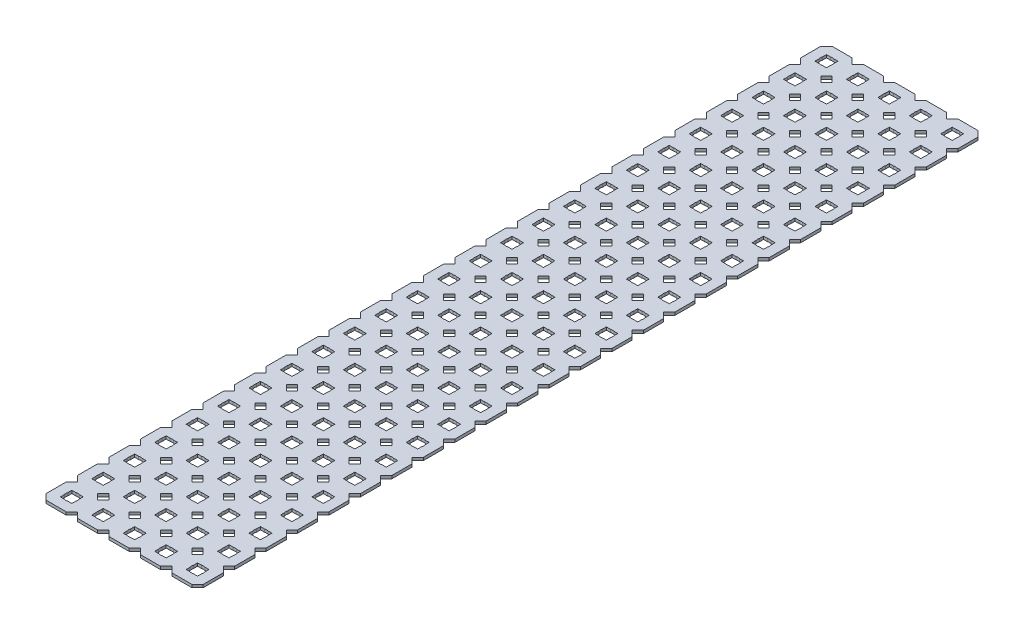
SolidWorks part; units mm, degrees
ref_plane "Front Plane" through (0, 0, 0) normal (0, 0, 1) x (1, 0, 0)
ref_plane "Top Plane" through (0, 0, 0) normal (0, 1, 0) x (1, 0, 0)
ref_plane "Right Plane" through (0, 0, 0) normal (1, 0, 0) x (0, 0, -1)
ref_plane "Plane1" through (0, 0, 0) normal (0, -1, 0) x (1, 0, 0)
sketch "Sketch1" plane through (0, 0, 0) normal (0, -1, 0) x (1, 0, 0)
  line L0 (2.281, -317.5) -> (10.419, -317.5)
  line L1 (10.419, -317.5) -> (12.7, -315.219)
  line L2 (12.7, -315.219) -> (14.981, -317.5)
  line L3 (14.981, -317.5) -> (23.119, -317.5)
  line L4 (23.119, -317.5) -> (25.4, -315.219)
  line L5 (25.4, -315.219) -> (27.681, -317.5)
  line L6 (27.681, -317.5) -> (35.819, -317.5)
  line L7 (35.819, -317.5) -> (38.1, -315.219)
  line L8 (38.1, -315.219) -> (40.381, -317.5)
  line L9 (40.381, -317.5) -> (48.519, -317.5)
  line L10 (48.519, -317.5) -> (50.8, -315.219)
  line L11 (50.8, -315.219) -> (53.081, -317.5)
  line L12 (53.081, -317.5) -> (61.219, -317.5)
  line L13 (61.219, -317.5) -> (63.5, -315.219)
  line L14 (63.5, -315.219) -> (63.5, -307.081)
  line L15 (63.5, -307.081) -> (61.219, -304.8)
  line L16 (61.219, -304.8) -> (63.5, -302.519)
  line L17 (63.5, -302.519) -> (63.5, -294.381)
  line L18 (63.5, -294.381) -> (61.219, -292.1)
  line L19 (61.219, -292.1) -> (63.5, -289.819)
  line L20 (63.5, -289.819) -> (63.5, -281.681)
  line L21 (63.5, -281.681) -> (61.219, -279.4)
  line L22 (61.219, -279.4) -> (63.5, -277.119)
  line L23 (63.5, -277.119) -> (63.5, -268.981)
  line L24 (63.5, -268.981) -> (61.219, -266.7)
  line L25 (61.219, -266.7) -> (63.5, -264.419)
  line L26 (63.5, -264.419) -> (63.5, -256.281)
  line L27 (63.5, -256.281) -> (61.219, -254)
  line L28 (61.219, -254) -> (63.5, -251.719)
  line L29 (63.5, -251.719) -> (63.5, -243.581)
  line L30 (63.5, -243.581) -> (61.219, -241.3)
  line L31 (61.219, -241.3) -> (63.5, -239.019)
  line L32 (63.5, -239.019) -> (63.5, -230.881)
  line L33 (63.5, -230.881) -> (61.219, -228.6)
  line L34 (61.219, -228.6) -> (63.5, -226.319)
  line L35 (63.5, -226.319) -> (63.5, -218.181)
  line L36 (63.5, -218.181) -> (61.219, -215.9)
  line L37 (61.219, -215.9) -> (63.5, -213.619)
  line L38 (63.5, -213.619) -> (63.5, -205.481)
  line L39 (63.5, -205.481) -> (61.219, -203.2)
  line L40 (61.219, -203.2) -> (63.5, -200.919)
  line L41 (63.5, -200.919) -> (63.5, -192.781)
  line L42 (63.5, -192.781) -> (61.219, -190.5)
  line L43 (61.219, -190.5) -> (63.5, -188.219)
  line L44 (63.5, -188.219) -> (63.5, -180.081)
  line L45 (63.5, -180.081) -> (61.219, -177.8)
  line L46 (61.219, -177.8) -> (63.5, -175.519)
  line L47 (63.5, -175.519) -> (63.5, -167.381)
  line L48 (63.5, -167.381) -> (61.219, -165.1)
  line L49 (61.219, -165.1) -> (63.5, -162.819)
  line L50 (63.5, -162.819) -> (63.5, -154.681)
  line L51 (63.5, -154.681) -> (61.219, -152.4)
  line L52 (61.219, -152.4) -> (63.5, -150.119)
  line L53 (63.5, -150.119) -> (63.5, -141.981)
  line L54 (63.5, -141.981) -> (61.219, -139.7)
  line L55 (61.219, -139.7) -> (63.5, -137.419)
  line L56 (63.5, -137.419) -> (63.5, -129.281)
  line L57 (63.5, -129.281) -> (61.219, -127)
  line L58 (61.219, -127) -> (63.5, -124.719)
  line L59 (63.5, -124.719) -> (63.5, -116.581)
  line L60 (63.5, -116.581) -> (61.219, -114.3)
  line L61 (61.219, -114.3) -> (63.5, -112.019)
  line L62 (63.5, -112.019) -> (63.5, -103.881)
  line L63 (63.5, -103.881) -> (61.219, -101.6)
  line L64 (61.219, -101.6) -> (63.5, -99.319)
  line L65 (63.5, -99.319) -> (63.5, -91.181)
  line L66 (63.5, -91.181) -> (61.219, -88.9)
  line L67 (61.219, -88.9) -> (63.5, -86.619)
  line L68 (63.5, -86.619) -> (63.5, -78.481)
  line L69 (63.5, -78.481) -> (61.219, -76.2)
  line L70 (61.219, -76.2) -> (63.5, -73.919)
  line L71 (63.5, -73.919) -> (63.5, -65.781)
  line L72 (63.5, -65.781) -> (61.219, -63.5)
  line L73 (61.219, -63.5) -> (63.5, -61.219)
  line L74 (63.5, -61.219) -> (63.5, -53.081)
  line L75 (63.5, -53.081) -> (61.219, -50.8)
  line L76 (61.219, -50.8) -> (63.5, -48.519)
  line L77 (63.5, -48.519) -> (63.5, -40.381)
  line L78 (63.5, -40.381) -> (61.219, -38.1)
  line L79 (61.219, -38.1) -> (63.5, -35.819)
  line L80 (63.5, -35.819) -> (63.5, -27.681)
  line L81 (63.5, -27.681) -> (61.219, -25.4)
  line L82 (61.219, -25.4) -> (63.5, -23.119)
  line L83 (63.5, -23.119) -> (63.5, -14.981)
  line L84 (63.5, -14.981) -> (61.219, -12.7)
  line L85 (61.219, -12.7) -> (63.5, -10.419)
  line L86 (63.5, -10.419) -> (63.5, -2.281)
  line L87 (63.5, -2.281) -> (61.219, 0)
  line L88 (61.219, 0) -> (53.081, 0)
  line L89 (53.081, 0) -> (50.8, -2.281)
  line L90 (50.8, -2.281) -> (48.519, 0)
  line L91 (48.519, 0) -> (40.381, 0)
  line L92 (40.381, 0) -> (38.1, -2.281)
  line L93 (38.1, -2.281) -> (35.819, 0)
  line L94 (35.819, 0) -> (27.681, 0)
  line L95 (27.681, 0) -> (25.4, -2.281)
  line L96 (25.4, -2.281) -> (23.119, 0)
  line L97 (23.119, 0) -> (14.981, 0)
  line L98 (14.981, 0) -> (12.7, -2.281)
  line L99 (12.7, -2.281) -> (10.419, 0)
  line L100 (10.419, 0) -> (2.281, 0)
  line L101 (2.281, 0) -> (0, -2.281)
  line L102 (0, -2.281) -> (0, -10.419)
  line L103 (0, -10.419) -> (2.281, -12.7)
  line L104 (2.281, -12.7) -> (0, -14.981)
  line L105 (0, -14.981) -> (0, -23.119)
  line L106 (0, -23.119) -> (2.281, -25.4)
  line L107 (2.281, -25.4) -> (0, -27.681)
  line L108 (0, -27.681) -> (0, -35.819)
  line L109 (0, -35.819) -> (2.281, -38.1)
  line L110 (2.281, -38.1) -> (0, -40.381)
  line L111 (0, -40.381) -> (0, -48.519)
  line L112 (0, -48.519) -> (2.281, -50.8)
  line L113 (2.281, -50.8) -> (0, -53.081)
  line L114 (0, -53.081) -> (0, -61.219)
  line L115 (0, -61.219) -> (2.281, -63.5)
  line L116 (2.281, -63.5) -> (0, -65.781)
  line L117 (0, -65.781) -> (0, -73.919)
  line L118 (0, -73.919) -> (2.281, -76.2)
  line L119 (2.281, -76.2) -> (0, -78.481)
  line L120 (0, -78.481) -> (0, -86.619)
  line L121 (0, -86.619) -> (2.281, -88.9)
  line L122 (2.281, -88.9) -> (0, -91.181)
  line L123 (0, -91.181) -> (0, -99.319)
  line L124 (0, -99.319) -> (2.281, -101.6)
  line L125 (2.281, -101.6) -> (0, -103.881)
  line L126 (0, -103.881) -> (0, -112.019)
  line L127 (0, -112.019) -> (2.281, -114.3)
  line L128 (2.281, -114.3) -> (0, -116.581)
  line L129 (0, -116.581) -> (0, -124.719)
  line L130 (0, -124.719) -> (2.281, -127)
  line L131 (2.281, -127) -> (0, -129.281)
  line L132 (0, -129.281) -> (0, -137.419)
  line L133 (0, -137.419) -> (2.281, -139.7)
  line L134 (2.281, -139.7) -> (0, -141.981)
  line L135 (0, -141.981) -> (0, -150.119)
  line L136 (0, -150.119) -> (2.281, -152.4)
  line L137 (2.281, -152.4) -> (0, -154.681)
  line L138 (0, -154.681) -> (0, -162.819)
  line L139 (0, -162.819) -> (2.281, -165.1)
  line L140 (2.281, -165.1) -> (0, -167.381)
  line L141 (0, -167.381) -> (0, -175.519)
  line L142 (0, -175.519) -> (2.281, -177.8)
  line L143 (2.281, -177.8) -> (0, -180.081)
  line L144 (0, -180.081) -> (0, -188.219)
  line L145 (0, -188.219) -> (2.281, -190.5)
  line L146 (2.281, -190.5) -> (0, -192.781)
  line L147 (0, -192.781) -> (0, -200.919)
  line L148 (0, -200.919) -> (2.281, -203.2)
  line L149 (2.281, -203.2) -> (0, -205.481)
  line L150 (0, -205.481) -> (0, -213.619)
  line L151 (0, -213.619) -> (2.281, -215.9)
  line L152 (2.281, -215.9) -> (0, -218.181)
  line L153 (0, -218.181) -> (0, -226.319)
  line L154 (0, -226.319) -> (2.281, -228.6)
  line L155 (2.281, -228.6) -> (0, -230.881)
  line L156 (0, -230.881) -> (0, -239.019)
  line L157 (0, -239.019) -> (2.281, -241.3)
  line L158 (2.281, -241.3) -> (0, -243.581)
  line L159 (0, -243.581) -> (0, -251.719)
  line L160 (0, -251.719) -> (2.281, -254)
  line L161 (2.281, -254) -> (0, -256.281)
  line L162 (0, -256.281) -> (0, -264.419)
  line L163 (0, -264.419) -> (2.281, -266.7)
  line L164 (2.281, -266.7) -> (0, -268.981)
  line L165 (0, -268.981) -> (0, -277.119)
  line L166 (0, -277.119) -> (2.281, -279.4)
  line L167 (2.281, -279.4) -> (0, -281.681)
  line L168 (0, -281.681) -> (0, -289.819)
  line L169 (0, -289.819) -> (2.281, -292.1)
  line L170 (2.281, -292.1) -> (0, -294.381)
  line L171 (0, -294.381) -> (0, -302.519)
  line L172 (0, -302.519) -> (2.281, -304.8)
  line L173 (2.281, -304.8) -> (0, -307.081)
  line L174 (0, -307.081) -> (0, -315.219)
  line L175 (0, -315.219) -> (2.281, -317.5)
  line L176 (14.981, -292.1) -> (12.7, -294.381)
  line L177 (12.7, -294.381) -> (10.419, -292.1)
  line L178 (10.419, -292.1) -> (12.7, -289.819)
  line L179 (12.7, -289.819) -> (14.981, -292.1)
  line L180 (14.981, -266.7) -> (12.7, -268.981)
  line L181 (12.7, -268.981) -> (10.419, -266.7)
  line L182 (10.419, -266.7) -> (12.7, -264.419)
  line L183 (12.7, -264.419) -> (14.981, -266.7)
  line L184 (14.981, -241.3) -> (12.7, -243.581)
  line L185 (12.7, -243.581) -> (10.419, -241.3)
  line L186 (10.419, -241.3) -> (12.7, -239.019)
  line L187 (12.7, -239.019) -> (14.981, -241.3)
  line L188 (14.981, -215.9) -> (12.7, -218.181)
  line L189 (12.7, -218.181) -> (10.419, -215.9)
  line L190 (10.419, -215.9) -> (12.7, -213.619)
  line L191 (12.7, -213.619) -> (14.981, -215.9)
  line L192 (14.981, -190.5) -> (12.7, -192.781)
  line L193 (12.7, -192.781) -> (10.419, -190.5)
  line L194 (10.419, -190.5) -> (12.7, -188.219)
  line L195 (12.7, -188.219) -> (14.981, -190.5)
  line L196 (14.981, -165.1) -> (12.7, -167.381)
  line L197 (12.7, -167.381) -> (10.419, -165.1)
  line L198 (10.419, -165.1) -> (12.7, -162.819)
  line L199 (12.7, -162.819) -> (14.981, -165.1)
  line L200 (14.981, -139.7) -> (12.7, -141.981)
  line L201 (12.7, -141.981) -> (10.419, -139.7)
  line L202 (10.419, -139.7) -> (12.7, -137.419)
  line L203 (12.7, -137.419) -> (14.981, -139.7)
  line L204 (14.981, -114.3) -> (12.7, -116.581)
  line L205 (12.7, -116.581) -> (10.419, -114.3)
  line L206 (10.419, -114.3) -> (12.7, -112.019)
  line L207 (12.7, -112.019) -> (14.981, -114.3)
  line L208 (14.981, -88.9) -> (12.7, -91.181)
  line L209 (12.7, -91.181) -> (10.419, -88.9)
  line L210 (10.419, -88.9) -> (12.7, -86.619)
  line L211 (12.7, -86.619) -> (14.981, -88.9)
  line L212 (14.981, -63.5) -> (12.7, -65.781)
  line L213 (12.7, -65.781) -> (10.419, -63.5)
  line L214 (10.419, -63.5) -> (12.7, -61.219)
  line L215 (12.7, -61.219) -> (14.981, -63.5)
  line L216 (14.981, -38.1) -> (12.7, -40.381)
  line L217 (12.7, -40.381) -> (10.419, -38.1)
  line L218 (10.419, -38.1) -> (12.7, -35.819)
  line L219 (12.7, -35.819) -> (14.981, -38.1)
  line L220 (14.981, -12.7) -> (12.7, -14.981)
  line L221 (12.7, -14.981) -> (10.419, -12.7)
  line L222 (10.419, -12.7) -> (12.7, -10.419)
  line L223 (12.7, -10.419) -> (14.981, -12.7)
  line L224 (27.681, -304.8) -> (25.4, -307.081)
  line L225 (25.4, -307.081) -> (23.119, -304.8)
  line L226 (23.119, -304.8) -> (25.4, -302.519)
  line L227 (25.4, -302.519) -> (27.681, -304.8)
  line L228 (27.681, -279.4) -> (25.4, -281.681)
  line L229 (25.4, -281.681) -> (23.119, -279.4)
  line L230 (23.119, -279.4) -> (25.4, -277.119)
  line L231 (25.4, -277.119) -> (27.681, -279.4)
  line L232 (27.681, -254) -> (25.4, -256.281)
  line L233 (25.4, -256.281) -> (23.119, -254)
  line L234 (23.119, -254) -> (25.4, -251.719)
  line L235 (25.4, -251.719) -> (27.681, -254)
  line L236 (27.681, -228.6) -> (25.4, -230.881)
  line L237 (25.4, -230.881) -> (23.119, -228.6)
  line L238 (23.119, -228.6) -> (25.4, -226.319)
  line L239 (25.4, -226.319) -> (27.681, -228.6)
  line L240 (27.681, -203.2) -> (25.4, -205.481)
  line L241 (25.4, -205.481) -> (23.119, -203.2)
  line L242 (23.119, -203.2) -> (25.4, -200.919)
  line L243 (25.4, -200.919) -> (27.681, -203.2)
  line L244 (27.681, -177.8) -> (25.4, -180.081)
  line L245 (25.4, -180.081) -> (23.119, -177.8)
  line L246 (23.119, -177.8) -> (25.4, -175.519)
  line L247 (25.4, -175.519) -> (27.681, -177.8)
  line L248 (27.681, -152.4) -> (25.4, -154.681)
  line L249 (25.4, -154.681) -> (23.119, -152.4)
  line L250 (23.119, -152.4) -> (25.4, -150.119)
  line L251 (25.4, -150.119) -> (27.681, -152.4)
  line L252 (27.681, -127) -> (25.4, -129.281)
  line L253 (25.4, -129.281) -> (23.119, -127)
  line L254 (23.119, -127) -> (25.4, -124.719)
  line L255 (25.4, -124.719) -> (27.681, -127)
  line L256 (27.681, -101.6) -> (25.4, -103.881)
  line L257 (25.4, -103.881) -> (23.119, -101.6)
  line L258 (23.119, -101.6) -> (25.4, -99.319)
  line L259 (25.4, -99.319) -> (27.681, -101.6)
  line L260 (27.681, -76.2) -> (25.4, -78.481)
  line L261 (25.4, -78.481) -> (23.119, -76.2)
  line L262 (23.119, -76.2) -> (25.4, -73.919)
  line L263 (25.4, -73.919) -> (27.681, -76.2)
  line L264 (27.681, -50.8) -> (25.4, -53.081)
  line L265 (25.4, -53.081) -> (23.119, -50.8)
  line L266 (23.119, -50.8) -> (25.4, -48.519)
  line L267 (25.4, -48.519) -> (27.681, -50.8)
  line L268 (27.681, -25.4) -> (25.4, -27.681)
  line L269 (25.4, -27.681) -> (23.119, -25.4)
  line L270 (23.119, -25.4) -> (25.4, -23.119)
  line L271 (25.4, -23.119) -> (27.681, -25.4)
  line L272 (40.381, -292.1) -> (38.1, -294.381)
  line L273 (38.1, -294.381) -> (35.819, -292.1)
  line L274 (35.819, -292.1) -> (38.1, -289.819)
  line L275 (38.1, -289.819) -> (40.381, -292.1)
  line L276 (40.381, -266.7) -> (38.1, -268.981)
  line L277 (38.1, -268.981) -> (35.819, -266.7)
  line L278 (35.819, -266.7) -> (38.1, -264.419)
  line L279 (38.1, -264.419) -> (40.381, -266.7)
  line L280 (40.381, -241.3) -> (38.1, -243.581)
  line L281 (38.1, -243.581) -> (35.819, -241.3)
  line L282 (35.819, -241.3) -> (38.1, -239.019)
  line L283 (38.1, -239.019) -> (40.381, -241.3)
  line L284 (40.381, -215.9) -> (38.1, -218.181)
  line L285 (38.1, -218.181) -> (35.819, -215.9)
  line L286 (35.819, -215.9) -> (38.1, -213.619)
  line L287 (38.1, -213.619) -> (40.381, -215.9)
  line L288 (40.381, -190.5) -> (38.1, -192.781)
  line L289 (38.1, -192.781) -> (35.819, -190.5)
  line L290 (35.819, -190.5) -> (38.1, -188.219)
  line L291 (38.1, -188.219) -> (40.381, -190.5)
  line L292 (40.381, -165.1) -> (38.1, -167.381)
  line L293 (38.1, -167.381) -> (35.819, -165.1)
  line L294 (35.819, -165.1) -> (38.1, -162.819)
  line L295 (38.1, -162.819) -> (40.381, -165.1)
  line L296 (40.381, -139.7) -> (38.1, -141.981)
  line L297 (38.1, -141.981) -> (35.819, -139.7)
  line L298 (35.819, -139.7) -> (38.1, -137.419)
  line L299 (38.1, -137.419) -> (40.381, -139.7)
  line L300 (40.381, -114.3) -> (38.1, -116.581)
  line L301 (38.1, -116.581) -> (35.819, -114.3)
  line L302 (35.819, -114.3) -> (38.1, -112.019)
  line L303 (38.1, -112.019) -> (40.381, -114.3)
  line L304 (40.381, -88.9) -> (38.1, -91.181)
  line L305 (38.1, -91.181) -> (35.819, -88.9)
  line L306 (35.819, -88.9) -> (38.1, -86.619)
  line L307 (38.1, -86.619) -> (40.381, -88.9)
  line L308 (40.381, -63.5) -> (38.1, -65.781)
  line L309 (38.1, -65.781) -> (35.819, -63.5)
  line L310 (35.819, -63.5) -> (38.1, -61.219)
  line L311 (38.1, -61.219) -> (40.381, -63.5)
  line L312 (40.381, -38.1) -> (38.1, -40.381)
  line L313 (38.1, -40.381) -> (35.819, -38.1)
  line L314 (35.819, -38.1) -> (38.1, -35.819)
  line L315 (38.1, -35.819) -> (40.381, -38.1)
  line L316 (40.381, -12.7) -> (38.1, -14.981)
  line L317 (38.1, -14.981) -> (35.819, -12.7)
  line L318 (35.819, -12.7) -> (38.1, -10.419)
  line L319 (38.1, -10.419) -> (40.381, -12.7)
  line L320 (53.081, -304.8) -> (50.8, -307.081)
  line L321 (50.8, -307.081) -> (48.519, -304.8)
  line L322 (48.519, -304.8) -> (50.8, -302.519)
  line L323 (50.8, -302.519) -> (53.081, -304.8)
  line L324 (53.081, -279.4) -> (50.8, -281.681)
  line L325 (50.8, -281.681) -> (48.519, -279.4)
  line L326 (48.519, -279.4) -> (50.8, -277.119)
  line L327 (50.8, -277.119) -> (53.081, -279.4)
  line L328 (53.081, -254) -> (50.8, -256.281)
  line L329 (50.8, -256.281) -> (48.519, -254)
  line L330 (48.519, -254) -> (50.8, -251.719)
  line L331 (50.8, -251.719) -> (53.081, -254)
  line L332 (53.081, -228.6) -> (50.8, -230.881)
  line L333 (50.8, -230.881) -> (48.519, -228.6)
  line L334 (48.519, -228.6) -> (50.8, -226.319)
  line L335 (50.8, -226.319) -> (53.081, -228.6)
  line L336 (53.081, -203.2) -> (50.8, -205.481)
  line L337 (50.8, -205.481) -> (48.519, -203.2)
  line L338 (48.519, -203.2) -> (50.8, -200.919)
  line L339 (50.8, -200.919) -> (53.081, -203.2)
  line L340 (53.081, -177.8) -> (50.8, -180.081)
  line L341 (50.8, -180.081) -> (48.519, -177.8)
  line L342 (48.519, -177.8) -> (50.8, -175.519)
  line L343 (50.8, -175.519) -> (53.081, -177.8)
  line L344 (53.081, -152.4) -> (50.8, -154.681)
  line L345 (50.8, -154.681) -> (48.519, -152.4)
  line L346 (48.519, -152.4) -> (50.8, -150.119)
  line L347 (50.8, -150.119) -> (53.081, -152.4)
  line L348 (53.081, -127) -> (50.8, -129.281)
  line L349 (50.8, -129.281) -> (48.519, -127)
  line L350 (48.519, -127) -> (50.8, -124.719)
  line L351 (50.8, -124.719) -> (53.081, -127)
  line L352 (53.081, -101.6) -> (50.8, -103.881)
  line L353 (50.8, -103.881) -> (48.519, -101.6)
  line L354 (48.519, -101.6) -> (50.8, -99.319)
  line L355 (50.8, -99.319) -> (53.081, -101.6)
  line L356 (53.081, -76.2) -> (50.8, -78.481)
  line L357 (50.8, -78.481) -> (48.519, -76.2)
  line L358 (48.519, -76.2) -> (50.8, -73.919)
  line L359 (50.8, -73.919) -> (53.081, -76.2)
  line L360 (53.081, -50.8) -> (50.8, -53.081)
  line L361 (50.8, -53.081) -> (48.519, -50.8)
  line L362 (48.519, -50.8) -> (50.8, -48.519)
  line L363 (50.8, -48.519) -> (53.081, -50.8)
  line L364 (53.081, -25.4) -> (50.8, -27.681)
  line L365 (50.8, -27.681) -> (48.519, -25.4)
  line L366 (48.519, -25.4) -> (50.8, -23.119)
  line L367 (50.8, -23.119) -> (53.081, -25.4)
  line L368 (4.0386, -308.8386) -> (8.6614, -308.8386)
  line L369 (8.6614, -308.8386) -> (8.6614, -313.4614)
  line L370 (8.6614, -313.4614) -> (4.0386, -313.4614)
  line L371 (4.0386, -313.4614) -> (4.0386, -308.8386)
  line L372 (16.7386, -308.8386) -> (21.3614, -308.8386)
  line L373 (21.3614, -308.8386) -> (21.3614, -313.4614)
  line L374 (21.3614, -313.4614) -> (16.7386, -313.4614)
  line L375 (16.7386, -313.4614) -> (16.7386, -308.8386)
  line L376 (29.4386, -308.8386) -> (34.0614, -308.8386)
  line L377 (34.0614, -308.8386) -> (34.0614, -313.4614)
  line L378 (34.0614, -313.4614) -> (29.4386, -313.4614)
  line L379 (29.4386, -313.4614) -> (29.4386, -308.8386)
  line L380 (42.1386, -308.8386) -> (46.7614, -308.8386)
  line L381 (46.7614, -308.8386) -> (46.7614, -313.4614)
  line L382 (46.7614, -313.4614) -> (42.1386, -313.4614)
  line L383 (42.1386, -313.4614) -> (42.1386, -308.8386)
  line L384 (54.8386, -308.8386) -> (59.4614, -308.8386)
  line L385 (59.4614, -308.8386) -> (59.4614, -313.4614)
  line L386 (59.4614, -313.4614) -> (54.8386, -313.4614)
  line L387 (54.8386, -313.4614) -> (54.8386, -308.8386)
  line L388 (4.0386, -296.1386) -> (8.6614, -296.1386)
  line L389 (8.6614, -296.1386) -> (8.6614, -300.7614)
  line L390 (8.6614, -300.7614) -> (4.0386, -300.7614)
  line L391 (4.0386, -300.7614) -> (4.0386, -296.1386)
  line L392 (54.8386, -296.1386) -> (59.4614, -296.1386)
  line L393 (59.4614, -296.1386) -> (59.4614, -300.7614)
  line L394 (59.4614, -300.7614) -> (54.8386, -300.7614)
  line L395 (54.8386, -300.7614) -> (54.8386, -296.1386)
  line L396 (4.0386, -283.4386) -> (8.6614, -283.4386)
  line L397 (8.6614, -283.4386) -> (8.6614, -288.0614)
  line L398 (8.6614, -288.0614) -> (4.0386, -288.0614)
  line L399 (4.0386, -288.0614) -> (4.0386, -283.4386)
  line L400 (54.8386, -283.4386) -> (59.4614, -283.4386)
  line L401 (59.4614, -283.4386) -> (59.4614, -288.0614)
  line L402 (59.4614, -288.0614) -> (54.8386, -288.0614)
  line L403 (54.8386, -288.0614) -> (54.8386, -283.4386)
  line L404 (4.0386, -270.7386) -> (8.6614, -270.7386)
  line L405 (8.6614, -270.7386) -> (8.6614, -275.3614)
  line L406 (8.6614, -275.3614) -> (4.0386, -275.3614)
  line L407 (4.0386, -275.3614) -> (4.0386, -270.7386)
  line L408 (54.8386, -270.7386) -> (59.4614, -270.7386)
  line L409 (59.4614, -270.7386) -> (59.4614, -275.3614)
  line L410 (59.4614, -275.3614) -> (54.8386, -275.3614)
  line L411 (54.8386, -275.3614) -> (54.8386, -270.7386)
  line L412 (4.0386, -258.0386) -> (8.6614, -258.0386)
  line L413 (8.6614, -258.0386) -> (8.6614, -262.6614)
  line L414 (8.6614, -262.6614) -> (4.0386, -262.6614)
  line L415 (4.0386, -262.6614) -> (4.0386, -258.0386)
  line L416 (54.8386, -258.0386) -> (59.4614, -258.0386)
  line L417 (59.4614, -258.0386) -> (59.4614, -262.6614)
  line L418 (59.4614, -262.6614) -> (54.8386, -262.6614)
  line L419 (54.8386, -262.6614) -> (54.8386, -258.0386)
  line L420 (4.0386, -245.3386) -> (8.6614, -245.3386)
  line L421 (8.6614, -245.3386) -> (8.6614, -249.9614)
  line L422 (8.6614, -249.9614) -> (4.0386, -249.9614)
  line L423 (4.0386, -249.9614) -> (4.0386, -245.3386)
  line L424 (54.8386, -245.3386) -> (59.4614, -245.3386)
  line L425 (59.4614, -245.3386) -> (59.4614, -249.9614)
  line L426 (59.4614, -249.9614) -> (54.8386, -249.9614)
  line L427 (54.8386, -249.9614) -> (54.8386, -245.3386)
  line L428 (4.0386, -232.6386) -> (8.6614, -232.6386)
  line L429 (8.6614, -232.6386) -> (8.6614, -237.2614)
  line L430 (8.6614, -237.2614) -> (4.0386, -237.2614)
  line L431 (4.0386, -237.2614) -> (4.0386, -232.6386)
  line L432 (54.8386, -232.6386) -> (59.4614, -232.6386)
  line L433 (59.4614, -232.6386) -> (59.4614, -237.2614)
  line L434 (59.4614, -237.2614) -> (54.8386, -237.2614)
  line L435 (54.8386, -237.2614) -> (54.8386, -232.6386)
  line L436 (4.0386, -219.9386) -> (8.6614, -219.9386)
  line L437 (8.6614, -219.9386) -> (8.6614, -224.5614)
  line L438 (8.6614, -224.5614) -> (4.0386, -224.5614)
  line L439 (4.0386, -224.5614) -> (4.0386, -219.9386)
  line L440 (54.8386, -219.9386) -> (59.4614, -219.9386)
  line L441 (59.4614, -219.9386) -> (59.4614, -224.5614)
  line L442 (59.4614, -224.5614) -> (54.8386, -224.5614)
  line L443 (54.8386, -224.5614) -> (54.8386, -219.9386)
  line L444 (4.0386, -207.2386) -> (8.6614, -207.2386)
  line L445 (8.6614, -207.2386) -> (8.6614, -211.8614)
  line L446 (8.6614, -211.8614) -> (4.0386, -211.8614)
  line L447 (4.0386, -211.8614) -> (4.0386, -207.2386)
  line L448 (54.8386, -207.2386) -> (59.4614, -207.2386)
  line L449 (59.4614, -207.2386) -> (59.4614, -211.8614)
  line L450 (59.4614, -211.8614) -> (54.8386, -211.8614)
  line L451 (54.8386, -211.8614) -> (54.8386, -207.2386)
  line L452 (4.0386, -194.5386) -> (8.6614, -194.5386)
  line L453 (8.6614, -194.5386) -> (8.6614, -199.1614)
  line L454 (8.6614, -199.1614) -> (4.0386, -199.1614)
  line L455 (4.0386, -199.1614) -> (4.0386, -194.5386)
  line L456 (54.8386, -194.5386) -> (59.4614, -194.5386)
  line L457 (59.4614, -194.5386) -> (59.4614, -199.1614)
  line L458 (59.4614, -199.1614) -> (54.8386, -199.1614)
  line L459 (54.8386, -199.1614) -> (54.8386, -194.5386)
  line L460 (4.0386, -181.8386) -> (8.6614, -181.8386)
  line L461 (8.6614, -181.8386) -> (8.6614, -186.4614)
  line L462 (8.6614, -186.4614) -> (4.0386, -186.4614)
  line L463 (4.0386, -186.4614) -> (4.0386, -181.8386)
  line L464 (54.8386, -181.8386) -> (59.4614, -181.8386)
  line L465 (59.4614, -181.8386) -> (59.4614, -186.4614)
  line L466 (59.4614, -186.4614) -> (54.8386, -186.4614)
  line L467 (54.8386, -186.4614) -> (54.8386, -181.8386)
  line L468 (4.0386, -169.1386) -> (8.6614, -169.1386)
  line L469 (8.6614, -169.1386) -> (8.6614, -173.7614)
  line L470 (8.6614, -173.7614) -> (4.0386, -173.7614)
  line L471 (4.0386, -173.7614) -> (4.0386, -169.1386)
  line L472 (54.8386, -169.1386) -> (59.4614, -169.1386)
  line L473 (59.4614, -169.1386) -> (59.4614, -173.7614)
  line L474 (59.4614, -173.7614) -> (54.8386, -173.7614)
  line L475 (54.8386, -173.7614) -> (54.8386, -169.1386)
  line L476 (4.0386, -156.4386) -> (8.6614, -156.4386)
  line L477 (8.6614, -156.4386) -> (8.6614, -161.0614)
  line L478 (8.6614, -161.0614) -> (4.0386, -161.0614)
  line L479 (4.0386, -161.0614) -> (4.0386, -156.4386)
  line L480 (54.8386, -156.4386) -> (59.4614, -156.4386)
  line L481 (59.4614, -156.4386) -> (59.4614, -161.0614)
  line L482 (59.4614, -161.0614) -> (54.8386, -161.0614)
  line L483 (54.8386, -161.0614) -> (54.8386, -156.4386)
  line L484 (4.0386, -143.7386) -> (8.6614, -143.7386)
  line L485 (8.6614, -143.7386) -> (8.6614, -148.3614)
  line L486 (8.6614, -148.3614) -> (4.0386, -148.3614)
  line L487 (4.0386, -148.3614) -> (4.0386, -143.7386)
  line L488 (54.8386, -143.7386) -> (59.4614, -143.7386)
  line L489 (59.4614, -143.7386) -> (59.4614, -148.3614)
  line L490 (59.4614, -148.3614) -> (54.8386, -148.3614)
  line L491 (54.8386, -148.3614) -> (54.8386, -143.7386)
  line L492 (4.0386, -131.0386) -> (8.6614, -131.0386)
  line L493 (8.6614, -131.0386) -> (8.6614, -135.6614)
  line L494 (8.6614, -135.6614) -> (4.0386, -135.6614)
  line L495 (4.0386, -135.6614) -> (4.0386, -131.0386)
  line L496 (54.8386, -131.0386) -> (59.4614, -131.0386)
  line L497 (59.4614, -131.0386) -> (59.4614, -135.6614)
  line L498 (59.4614, -135.6614) -> (54.8386, -135.6614)
  line L499 (54.8386, -135.6614) -> (54.8386, -131.0386)
  line L500 (4.0386, -118.3386) -> (8.6614, -118.3386)
  line L501 (8.6614, -118.3386) -> (8.6614, -122.9614)
  line L502 (8.6614, -122.9614) -> (4.0386, -122.9614)
  line L503 (4.0386, -122.9614) -> (4.0386, -118.3386)
  line L504 (54.8386, -118.3386) -> (59.4614, -118.3386)
  line L505 (59.4614, -118.3386) -> (59.4614, -122.9614)
  line L506 (59.4614, -122.9614) -> (54.8386, -122.9614)
  line L507 (54.8386, -122.9614) -> (54.8386, -118.3386)
  line L508 (4.0386, -105.6386) -> (8.6614, -105.6386)
  line L509 (8.6614, -105.6386) -> (8.6614, -110.2614)
  line L510 (8.6614, -110.2614) -> (4.0386, -110.2614)
  line L511 (4.0386, -110.2614) -> (4.0386, -105.6386)
  line L512 (54.8386, -105.6386) -> (59.4614, -105.6386)
  line L513 (59.4614, -105.6386) -> (59.4614, -110.2614)
  line L514 (59.4614, -110.2614) -> (54.8386, -110.2614)
  line L515 (54.8386, -110.2614) -> (54.8386, -105.6386)
  line L516 (4.0386, -92.9386) -> (8.6614, -92.9386)
  line L517 (8.6614, -92.9386) -> (8.6614, -97.5614)
  line L518 (8.6614, -97.5614) -> (4.0386, -97.5614)
  line L519 (4.0386, -97.5614) -> (4.0386, -92.9386)
  line L520 (54.8386, -92.9386) -> (59.4614, -92.9386)
  line L521 (59.4614, -92.9386) -> (59.4614, -97.5614)
  line L522 (59.4614, -97.5614) -> (54.8386, -97.5614)
  line L523 (54.8386, -97.5614) -> (54.8386, -92.9386)
  line L524 (4.0386, -80.2386) -> (8.6614, -80.2386)
  line L525 (8.6614, -80.2386) -> (8.6614, -84.8614)
  line L526 (8.6614, -84.8614) -> (4.0386, -84.8614)
  line L527 (4.0386, -84.8614) -> (4.0386, -80.2386)
  line L528 (54.8386, -80.2386) -> (59.4614, -80.2386)
  line L529 (59.4614, -80.2386) -> (59.4614, -84.8614)
  line L530 (59.4614, -84.8614) -> (54.8386, -84.8614)
  line L531 (54.8386, -84.8614) -> (54.8386, -80.2386)
  line L532 (4.0386, -67.5386) -> (8.6614, -67.5386)
  line L533 (8.6614, -67.5386) -> (8.6614, -72.1614)
  line L534 (8.6614, -72.1614) -> (4.0386, -72.1614)
  line L535 (4.0386, -72.1614) -> (4.0386, -67.5386)
  line L536 (54.8386, -67.5386) -> (59.4614, -67.5386)
  line L537 (59.4614, -67.5386) -> (59.4614, -72.1614)
  line L538 (59.4614, -72.1614) -> (54.8386, -72.1614)
  line L539 (54.8386, -72.1614) -> (54.8386, -67.5386)
  line L540 (4.0386, -54.8386) -> (8.6614, -54.8386)
  line L541 (8.6614, -54.8386) -> (8.6614, -59.4614)
  line L542 (8.6614, -59.4614) -> (4.0386, -59.4614)
  line L543 (4.0386, -59.4614) -> (4.0386, -54.8386)
  line L544 (54.8386, -54.8386) -> (59.4614, -54.8386)
  line L545 (59.4614, -54.8386) -> (59.4614, -59.4614)
  line L546 (59.4614, -59.4614) -> (54.8386, -59.4614)
  line L547 (54.8386, -59.4614) -> (54.8386, -54.8386)
  line L548 (4.0386, -42.1386) -> (8.6614, -42.1386)
  line L549 (8.6614, -42.1386) -> (8.6614, -46.7614)
  line L550 (8.6614, -46.7614) -> (4.0386, -46.7614)
  line L551 (4.0386, -46.7614) -> (4.0386, -42.1386)
  line L552 (54.8386, -42.1386) -> (59.4614, -42.1386)
  line L553 (59.4614, -42.1386) -> (59.4614, -46.7614)
  line L554 (59.4614, -46.7614) -> (54.8386, -46.7614)
  line L555 (54.8386, -46.7614) -> (54.8386, -42.1386)
  line L556 (4.0386, -29.4386) -> (8.6614, -29.4386)
  line L557 (8.6614, -29.4386) -> (8.6614, -34.0614)
  line L558 (8.6614, -34.0614) -> (4.0386, -34.0614)
  line L559 (4.0386, -34.0614) -> (4.0386, -29.4386)
  line L560 (54.8386, -29.4386) -> (59.4614, -29.4386)
  line L561 (59.4614, -29.4386) -> (59.4614, -34.0614)
  line L562 (59.4614, -34.0614) -> (54.8386, -34.0614)
  line L563 (54.8386, -34.0614) -> (54.8386, -29.4386)
  line L564 (4.0386, -16.7386) -> (8.6614, -16.7386)
  line L565 (8.6614, -16.7386) -> (8.6614, -21.3614)
  line L566 (8.6614, -21.3614) -> (4.0386, -21.3614)
  line L567 (4.0386, -21.3614) -> (4.0386, -16.7386)
  line L568 (54.8386, -16.7386) -> (59.4614, -16.7386)
  line L569 (59.4614, -16.7386) -> (59.4614, -21.3614)
  line L570 (59.4614, -21.3614) -> (54.8386, -21.3614)
  line L571 (54.8386, -21.3614) -> (54.8386, -16.7386)
  line L572 (4.0386, -4.0386) -> (8.6614, -4.0386)
  line L573 (8.6614, -4.0386) -> (8.6614, -8.6614)
  line L574 (8.6614, -8.6614) -> (4.0386, -8.6614)
  line L575 (4.0386, -8.6614) -> (4.0386, -4.0386)
  line L576 (16.7386, -4.0386) -> (21.3614, -4.0386)
  line L577 (21.3614, -4.0386) -> (21.3614, -8.6614)
  line L578 (21.3614, -8.6614) -> (16.7386, -8.6614)
  line L579 (16.7386, -8.6614) -> (16.7386, -4.0386)
  line L580 (29.4386, -4.0386) -> (34.0614, -4.0386)
  line L581 (34.0614, -4.0386) -> (34.0614, -8.6614)
  line L582 (34.0614, -8.6614) -> (29.4386, -8.6614)
  line L583 (29.4386, -8.6614) -> (29.4386, -4.0386)
  line L584 (16.7386, -296.1386) -> (21.3614, -296.1386)
  line L585 (21.3614, -296.1386) -> (21.3614, -300.7614)
  line L586 (21.3614, -300.7614) -> (16.7386, -300.7614)
  line L587 (16.7386, -300.7614) -> (16.7386, -296.1386)
  line L588 (29.4386, -296.1386) -> (34.0614, -296.1386)
  line L589 (34.0614, -296.1386) -> (34.0614, -300.7614)
  line L590 (34.0614, -300.7614) -> (29.4386, -300.7614)
  line L591 (29.4386, -300.7614) -> (29.4386, -296.1386)
  line L592 (42.1386, -296.1386) -> (46.7614, -296.1386)
  line L593 (46.7614, -296.1386) -> (46.7614, -300.7614)
  line L594 (46.7614, -300.7614) -> (42.1386, -300.7614)
  line L595 (42.1386, -300.7614) -> (42.1386, -296.1386)
  line L596 (16.7386, -283.4386) -> (21.3614, -283.4386)
  line L597 (21.3614, -283.4386) -> (21.3614, -288.0614)
  line L598 (21.3614, -288.0614) -> (16.7386, -288.0614)
  line L599 (16.7386, -288.0614) -> (16.7386, -283.4386)
  line L600 (29.4386, -283.4386) -> (34.0614, -283.4386)
  line L601 (34.0614, -283.4386) -> (34.0614, -288.0614)
  line L602 (34.0614, -288.0614) -> (29.4386, -288.0614)
  line L603 (29.4386, -288.0614) -> (29.4386, -283.4386)
  line L604 (42.1386, -283.4386) -> (46.7614, -283.4386)
  line L605 (46.7614, -283.4386) -> (46.7614, -288.0614)
  line L606 (46.7614, -288.0614) -> (42.1386, -288.0614)
  line L607 (42.1386, -288.0614) -> (42.1386, -283.4386)
  line L608 (16.7386, -270.7386) -> (21.3614, -270.7386)
  line L609 (21.3614, -270.7386) -> (21.3614, -275.3614)
  line L610 (21.3614, -275.3614) -> (16.7386, -275.3614)
  line L611 (16.7386, -275.3614) -> (16.7386, -270.7386)
  line L612 (29.4386, -270.7386) -> (34.0614, -270.7386)
  line L613 (34.0614, -270.7386) -> (34.0614, -275.3614)
  line L614 (34.0614, -275.3614) -> (29.4386, -275.3614)
  line L615 (29.4386, -275.3614) -> (29.4386, -270.7386)
  line L616 (42.1386, -270.7386) -> (46.7614, -270.7386)
  line L617 (46.7614, -270.7386) -> (46.7614, -275.3614)
  line L618 (46.7614, -275.3614) -> (42.1386, -275.3614)
  line L619 (42.1386, -275.3614) -> (42.1386, -270.7386)
  line L620 (16.7386, -258.0386) -> (21.3614, -258.0386)
  line L621 (21.3614, -258.0386) -> (21.3614, -262.6614)
  line L622 (21.3614, -262.6614) -> (16.7386, -262.6614)
  line L623 (16.7386, -262.6614) -> (16.7386, -258.0386)
  line L624 (29.4386, -258.0386) -> (34.0614, -258.0386)
  line L625 (34.0614, -258.0386) -> (34.0614, -262.6614)
  line L626 (34.0614, -262.6614) -> (29.4386, -262.6614)
  line L627 (29.4386, -262.6614) -> (29.4386, -258.0386)
  line L628 (42.1386, -258.0386) -> (46.7614, -258.0386)
  line L629 (46.7614, -258.0386) -> (46.7614, -262.6614)
  line L630 (46.7614, -262.6614) -> (42.1386, -262.6614)
  line L631 (42.1386, -262.6614) -> (42.1386, -258.0386)
  line L632 (16.7386, -245.3386) -> (21.3614, -245.3386)
  line L633 (21.3614, -245.3386) -> (21.3614, -249.9614)
  line L634 (21.3614, -249.9614) -> (16.7386, -249.9614)
  line L635 (16.7386, -249.9614) -> (16.7386, -245.3386)
  line L636 (29.4386, -245.3386) -> (34.0614, -245.3386)
  line L637 (34.0614, -245.3386) -> (34.0614, -249.9614)
  line L638 (34.0614, -249.9614) -> (29.4386, -249.9614)
  line L639 (29.4386, -249.9614) -> (29.4386, -245.3386)
  line L640 (42.1386, -245.3386) -> (46.7614, -245.3386)
  line L641 (46.7614, -245.3386) -> (46.7614, -249.9614)
  line L642 (46.7614, -249.9614) -> (42.1386, -249.9614)
  line L643 (42.1386, -249.9614) -> (42.1386, -245.3386)
  line L644 (16.7386, -232.6386) -> (21.3614, -232.6386)
  line L645 (21.3614, -232.6386) -> (21.3614, -237.2614)
  line L646 (21.3614, -237.2614) -> (16.7386, -237.2614)
  line L647 (16.7386, -237.2614) -> (16.7386, -232.6386)
  line L648 (29.4386, -232.6386) -> (34.0614, -232.6386)
  line L649 (34.0614, -232.6386) -> (34.0614, -237.2614)
  line L650 (34.0614, -237.2614) -> (29.4386, -237.2614)
  line L651 (29.4386, -237.2614) -> (29.4386, -232.6386)
  line L652 (42.1386, -232.6386) -> (46.7614, -232.6386)
  line L653 (46.7614, -232.6386) -> (46.7614, -237.2614)
  line L654 (46.7614, -237.2614) -> (42.1386, -237.2614)
  line L655 (42.1386, -237.2614) -> (42.1386, -232.6386)
  line L656 (16.7386, -219.9386) -> (21.3614, -219.9386)
  line L657 (21.3614, -219.9386) -> (21.3614, -224.5614)
  line L658 (21.3614, -224.5614) -> (16.7386, -224.5614)
  line L659 (16.7386, -224.5614) -> (16.7386, -219.9386)
  line L660 (29.4386, -219.9386) -> (34.0614, -219.9386)
  line L661 (34.0614, -219.9386) -> (34.0614, -224.5614)
  line L662 (34.0614, -224.5614) -> (29.4386, -224.5614)
  line L663 (29.4386, -224.5614) -> (29.4386, -219.9386)
  line L664 (42.1386, -219.9386) -> (46.7614, -219.9386)
  line L665 (46.7614, -219.9386) -> (46.7614, -224.5614)
  line L666 (46.7614, -224.5614) -> (42.1386, -224.5614)
  line L667 (42.1386, -224.5614) -> (42.1386, -219.9386)
  line L668 (16.7386, -207.2386) -> (21.3614, -207.2386)
  line L669 (21.3614, -207.2386) -> (21.3614, -211.8614)
  line L670 (21.3614, -211.8614) -> (16.7386, -211.8614)
  line L671 (16.7386, -211.8614) -> (16.7386, -207.2386)
  line L672 (29.4386, -207.2386) -> (34.0614, -207.2386)
  line L673 (34.0614, -207.2386) -> (34.0614, -211.8614)
  line L674 (34.0614, -211.8614) -> (29.4386, -211.8614)
  line L675 (29.4386, -211.8614) -> (29.4386, -207.2386)
  line L676 (42.1386, -207.2386) -> (46.7614, -207.2386)
  line L677 (46.7614, -207.2386) -> (46.7614, -211.8614)
  line L678 (46.7614, -211.8614) -> (42.1386, -211.8614)
  line L679 (42.1386, -211.8614) -> (42.1386, -207.2386)
  line L680 (16.7386, -194.5386) -> (21.3614, -194.5386)
  line L681 (21.3614, -194.5386) -> (21.3614, -199.1614)
  line L682 (21.3614, -199.1614) -> (16.7386, -199.1614)
  line L683 (16.7386, -199.1614) -> (16.7386, -194.5386)
  line L684 (29.4386, -194.5386) -> (34.0614, -194.5386)
  line L685 (34.0614, -194.5386) -> (34.0614, -199.1614)
  line L686 (34.0614, -199.1614) -> (29.4386, -199.1614)
  line L687 (29.4386, -199.1614) -> (29.4386, -194.5386)
  line L688 (42.1386, -194.5386) -> (46.7614, -194.5386)
  line L689 (46.7614, -194.5386) -> (46.7614, -199.1614)
  line L690 (46.7614, -199.1614) -> (42.1386, -199.1614)
  line L691 (42.1386, -199.1614) -> (42.1386, -194.5386)
  line L692 (16.7386, -181.8386) -> (21.3614, -181.8386)
  line L693 (21.3614, -181.8386) -> (21.3614, -186.4614)
  line L694 (21.3614, -186.4614) -> (16.7386, -186.4614)
  line L695 (16.7386, -186.4614) -> (16.7386, -181.8386)
  line L696 (29.4386, -181.8386) -> (34.0614, -181.8386)
  line L697 (34.0614, -181.8386) -> (34.0614, -186.4614)
  line L698 (34.0614, -186.4614) -> (29.4386, -186.4614)
  line L699 (29.4386, -186.4614) -> (29.4386, -181.8386)
  line L700 (42.1386, -181.8386) -> (46.7614, -181.8386)
  line L701 (46.7614, -181.8386) -> (46.7614, -186.4614)
  line L702 (46.7614, -186.4614) -> (42.1386, -186.4614)
  line L703 (42.1386, -186.4614) -> (42.1386, -181.8386)
  line L704 (16.7386, -169.1386) -> (21.3614, -169.1386)
  line L705 (21.3614, -169.1386) -> (21.3614, -173.7614)
  line L706 (21.3614, -173.7614) -> (16.7386, -173.7614)
  line L707 (16.7386, -173.7614) -> (16.7386, -169.1386)
  line L708 (29.4386, -169.1386) -> (34.0614, -169.1386)
  line L709 (34.0614, -169.1386) -> (34.0614, -173.7614)
  line L710 (34.0614, -173.7614) -> (29.4386, -173.7614)
  line L711 (29.4386, -173.7614) -> (29.4386, -169.1386)
  line L712 (42.1386, -169.1386) -> (46.7614, -169.1386)
  line L713 (46.7614, -169.1386) -> (46.7614, -173.7614)
  line L714 (46.7614, -173.7614) -> (42.1386, -173.7614)
  line L715 (42.1386, -173.7614) -> (42.1386, -169.1386)
  line L716 (16.7386, -156.4386) -> (21.3614, -156.4386)
  line L717 (21.3614, -156.4386) -> (21.3614, -161.0614)
  line L718 (21.3614, -161.0614) -> (16.7386, -161.0614)
  line L719 (16.7386, -161.0614) -> (16.7386, -156.4386)
  line L720 (29.4386, -156.4386) -> (34.0614, -156.4386)
  line L721 (34.0614, -156.4386) -> (34.0614, -161.0614)
  line L722 (34.0614, -161.0614) -> (29.4386, -161.0614)
  line L723 (29.4386, -161.0614) -> (29.4386, -156.4386)
  line L724 (42.1386, -156.4386) -> (46.7614, -156.4386)
  line L725 (46.7614, -156.4386) -> (46.7614, -161.0614)
  line L726 (46.7614, -161.0614) -> (42.1386, -161.0614)
  line L727 (42.1386, -161.0614) -> (42.1386, -156.4386)
  line L728 (16.7386, -143.7386) -> (21.3614, -143.7386)
  line L729 (21.3614, -143.7386) -> (21.3614, -148.3614)
  line L730 (21.3614, -148.3614) -> (16.7386, -148.3614)
  line L731 (16.7386, -148.3614) -> (16.7386, -143.7386)
  line L732 (29.4386, -143.7386) -> (34.0614, -143.7386)
  line L733 (34.0614, -143.7386) -> (34.0614, -148.3614)
  line L734 (34.0614, -148.3614) -> (29.4386, -148.3614)
  line L735 (29.4386, -148.3614) -> (29.4386, -143.7386)
  line L736 (42.1386, -143.7386) -> (46.7614, -143.7386)
  line L737 (46.7614, -143.7386) -> (46.7614, -148.3614)
  line L738 (46.7614, -148.3614) -> (42.1386, -148.3614)
  line L739 (42.1386, -148.3614) -> (42.1386, -143.7386)
  line L740 (16.7386, -131.0386) -> (21.3614, -131.0386)
  line L741 (21.3614, -131.0386) -> (21.3614, -135.6614)
  line L742 (21.3614, -135.6614) -> (16.7386, -135.6614)
  line L743 (16.7386, -135.6614) -> (16.7386, -131.0386)
  line L744 (29.4386, -131.0386) -> (34.0614, -131.0386)
  line L745 (34.0614, -131.0386) -> (34.0614, -135.6614)
  line L746 (34.0614, -135.6614) -> (29.4386, -135.6614)
  line L747 (29.4386, -135.6614) -> (29.4386, -131.0386)
  line L748 (42.1386, -131.0386) -> (46.7614, -131.0386)
  line L749 (46.7614, -131.0386) -> (46.7614, -135.6614)
  line L750 (46.7614, -135.6614) -> (42.1386, -135.6614)
  line L751 (42.1386, -135.6614) -> (42.1386, -131.0386)
  line L752 (16.7386, -118.3386) -> (21.3614, -118.3386)
  line L753 (21.3614, -118.3386) -> (21.3614, -122.9614)
  line L754 (21.3614, -122.9614) -> (16.7386, -122.9614)
  line L755 (16.7386, -122.9614) -> (16.7386, -118.3386)
  line L756 (29.4386, -118.3386) -> (34.0614, -118.3386)
  line L757 (34.0614, -118.3386) -> (34.0614, -122.9614)
  line L758 (34.0614, -122.9614) -> (29.4386, -122.9614)
  line L759 (29.4386, -122.9614) -> (29.4386, -118.3386)
  line L760 (42.1386, -118.3386) -> (46.7614, -118.3386)
  line L761 (46.7614, -118.3386) -> (46.7614, -122.9614)
  line L762 (46.7614, -122.9614) -> (42.1386, -122.9614)
  line L763 (42.1386, -122.9614) -> (42.1386, -118.3386)
  line L764 (16.7386, -105.6386) -> (21.3614, -105.6386)
  line L765 (21.3614, -105.6386) -> (21.3614, -110.2614)
  line L766 (21.3614, -110.2614) -> (16.7386, -110.2614)
  line L767 (16.7386, -110.2614) -> (16.7386, -105.6386)
  line L768 (29.4386, -105.6386) -> (34.0614, -105.6386)
  line L769 (34.0614, -105.6386) -> (34.0614, -110.2614)
  line L770 (34.0614, -110.2614) -> (29.4386, -110.2614)
  line L771 (29.4386, -110.2614) -> (29.4386, -105.6386)
  line L772 (42.1386, -105.6386) -> (46.7614, -105.6386)
  line L773 (46.7614, -105.6386) -> (46.7614, -110.2614)
  line L774 (46.7614, -110.2614) -> (42.1386, -110.2614)
  line L775 (42.1386, -110.2614) -> (42.1386, -105.6386)
  line L776 (16.7386, -92.9386) -> (21.3614, -92.9386)
  line L777 (21.3614, -92.9386) -> (21.3614, -97.5614)
  line L778 (21.3614, -97.5614) -> (16.7386, -97.5614)
  line L779 (16.7386, -97.5614) -> (16.7386, -92.9386)
  line L780 (29.4386, -92.9386) -> (34.0614, -92.9386)
  line L781 (34.0614, -92.9386) -> (34.0614, -97.5614)
  line L782 (34.0614, -97.5614) -> (29.4386, -97.5614)
  line L783 (29.4386, -97.5614) -> (29.4386, -92.9386)
  line L784 (42.1386, -92.9386) -> (46.7614, -92.9386)
  line L785 (46.7614, -92.9386) -> (46.7614, -97.5614)
  line L786 (46.7614, -97.5614) -> (42.1386, -97.5614)
  line L787 (42.1386, -97.5614) -> (42.1386, -92.9386)
  line L788 (16.7386, -80.2386) -> (21.3614, -80.2386)
  line L789 (21.3614, -80.2386) -> (21.3614, -84.8614)
  line L790 (21.3614, -84.8614) -> (16.7386, -84.8614)
  line L791 (16.7386, -84.8614) -> (16.7386, -80.2386)
  line L792 (29.4386, -80.2386) -> (34.0614, -80.2386)
  line L793 (34.0614, -80.2386) -> (34.0614, -84.8614)
  line L794 (34.0614, -84.8614) -> (29.4386, -84.8614)
  line L795 (29.4386, -84.8614) -> (29.4386, -80.2386)
  line L796 (42.1386, -80.2386) -> (46.7614, -80.2386)
  line L797 (46.7614, -80.2386) -> (46.7614, -84.8614)
  line L798 (46.7614, -84.8614) -> (42.1386, -84.8614)
  line L799 (42.1386, -84.8614) -> (42.1386, -80.2386)
  line L800 (16.7386, -67.5386) -> (21.3614, -67.5386)
  line L801 (21.3614, -67.5386) -> (21.3614, -72.1614)
  line L802 (21.3614, -72.1614) -> (16.7386, -72.1614)
  line L803 (16.7386, -72.1614) -> (16.7386, -67.5386)
  line L804 (29.4386, -67.5386) -> (34.0614, -67.5386)
  line L805 (34.0614, -67.5386) -> (34.0614, -72.1614)
  line L806 (34.0614, -72.1614) -> (29.4386, -72.1614)
  line L807 (29.4386, -72.1614) -> (29.4386, -67.5386)
  line L808 (42.1386, -67.5386) -> (46.7614, -67.5386)
  line L809 (46.7614, -67.5386) -> (46.7614, -72.1614)
  line L810 (46.7614, -72.1614) -> (42.1386, -72.1614)
  line L811 (42.1386, -72.1614) -> (42.1386, -67.5386)
  line L812 (16.7386, -54.8386) -> (21.3614, -54.8386)
  line L813 (21.3614, -54.8386) -> (21.3614, -59.4614)
  line L814 (21.3614, -59.4614) -> (16.7386, -59.4614)
  line L815 (16.7386, -59.4614) -> (16.7386, -54.8386)
  line L816 (29.4386, -54.8386) -> (34.0614, -54.8386)
  line L817 (34.0614, -54.8386) -> (34.0614, -59.4614)
  line L818 (34.0614, -59.4614) -> (29.4386, -59.4614)
  line L819 (29.4386, -59.4614) -> (29.4386, -54.8386)
  line L820 (42.1386, -54.8386) -> (46.7614, -54.8386)
  line L821 (46.7614, -54.8386) -> (46.7614, -59.4614)
  line L822 (46.7614, -59.4614) -> (42.1386, -59.4614)
  line L823 (42.1386, -59.4614) -> (42.1386, -54.8386)
  line L824 (16.7386, -42.1386) -> (21.3614, -42.1386)
  line L825 (21.3614, -42.1386) -> (21.3614, -46.7614)
  line L826 (21.3614, -46.7614) -> (16.7386, -46.7614)
  line L827 (16.7386, -46.7614) -> (16.7386, -42.1386)
  line L828 (29.4386, -42.1386) -> (34.0614, -42.1386)
  line L829 (34.0614, -42.1386) -> (34.0614, -46.7614)
  line L830 (34.0614, -46.7614) -> (29.4386, -46.7614)
  line L831 (29.4386, -46.7614) -> (29.4386, -42.1386)
  line L832 (42.1386, -42.1386) -> (46.7614, -42.1386)
  line L833 (46.7614, -42.1386) -> (46.7614, -46.7614)
  line L834 (46.7614, -46.7614) -> (42.1386, -46.7614)
  line L835 (42.1386, -46.7614) -> (42.1386, -42.1386)
  line L836 (16.7386, -29.4386) -> (21.3614, -29.4386)
  line L837 (21.3614, -29.4386) -> (21.3614, -34.0614)
  line L838 (21.3614, -34.0614) -> (16.7386, -34.0614)
  line L839 (16.7386, -34.0614) -> (16.7386, -29.4386)
  line L840 (29.4386, -29.4386) -> (34.0614, -29.4386)
  line L841 (34.0614, -29.4386) -> (34.0614, -34.0614)
  line L842 (34.0614, -34.0614) -> (29.4386, -34.0614)
  line L843 (29.4386, -34.0614) -> (29.4386, -29.4386)
  line L844 (42.1386, -29.4386) -> (46.7614, -29.4386)
  line L845 (46.7614, -29.4386) -> (46.7614, -34.0614)
  line L846 (46.7614, -34.0614) -> (42.1386, -34.0614)
  line L847 (42.1386, -34.0614) -> (42.1386, -29.4386)
  line L848 (16.7386, -16.7386) -> (21.3614, -16.7386)
  line L849 (21.3614, -16.7386) -> (21.3614, -21.3614)
  line L850 (21.3614, -21.3614) -> (16.7386, -21.3614)
  line L851 (16.7386, -21.3614) -> (16.7386, -16.7386)
  line L852 (29.4386, -16.7386) -> (34.0614, -16.7386)
  line L853 (34.0614, -16.7386) -> (34.0614, -21.3614)
  line L854 (34.0614, -21.3614) -> (29.4386, -21.3614)
  line L855 (29.4386, -21.3614) -> (29.4386, -16.7386)
  line L856 (54.8386, -8.6614) -> (54.8386, -4.0386)
  line L857 (54.8386, -4.0386) -> (59.4614, -4.0386)
  line L858 (59.4614, -4.0386) -> (59.4614, -8.6614)
  line L859 (59.4614, -8.6614) -> (54.8386, -8.6614)
  line L860 (42.1386, -21.3614) -> (42.1386, -16.7386)
  line L861 (42.1386, -16.7386) -> (46.7614, -16.7386)
  line L862 (46.7614, -16.7386) -> (46.7614, -21.3614)
  line L863 (46.7614, -21.3614) -> (42.1386, -21.3614)
  line L864 (42.1386, -8.6614) -> (42.1386, -4.0386)
  line L865 (42.1386, -4.0386) -> (46.7614, -4.0386)
  line L866 (46.7614, -4.0386) -> (46.7614, -8.6614)
  line L867 (46.7614, -8.6614) -> (42.1386, -8.6614)
  line L868 (53.081, -12.7) -> (50.8, -14.981)
  line L869 (50.8, -14.981) -> (48.519, -12.7)
  line L870 (48.519, -12.7) -> (50.8, -10.419)
  line L871 (50.8, -10.419) -> (53.081, -12.7)
  line L872 (53.081, -38.1) -> (50.8, -40.381)
  line L873 (50.8, -40.381) -> (48.519, -38.1)
  line L874 (48.519, -38.1) -> (50.8, -35.819)
  line L875 (50.8, -35.819) -> (53.081, -38.1)
  line L876 (53.081, -63.5) -> (50.8, -65.781)
  line L877 (50.8, -65.781) -> (48.519, -63.5)
  line L878 (48.519, -63.5) -> (50.8, -61.219)
  line L879 (50.8, -61.219) -> (53.081, -63.5)
  line L880 (53.081, -88.9) -> (50.8, -91.181)
  line L881 (50.8, -91.181) -> (48.519, -88.9)
  line L882 (48.519, -88.9) -> (50.8, -86.619)
  line L883 (50.8, -86.619) -> (53.081, -88.9)
  line L884 (53.081, -114.3) -> (50.8, -116.581)
  line L885 (50.8, -116.581) -> (48.519, -114.3)
  line L886 (48.519, -114.3) -> (50.8, -112.019)
  line L887 (50.8, -112.019) -> (53.081, -114.3)
  line L888 (53.081, -139.7) -> (50.8, -141.981)
  line L889 (50.8, -141.981) -> (48.519, -139.7)
  line L890 (48.519, -139.7) -> (50.8, -137.419)
  line L891 (50.8, -137.419) -> (53.081, -139.7)
  line L892 (53.081, -165.1) -> (50.8, -167.381)
  line L893 (50.8, -167.381) -> (48.519, -165.1)
  line L894 (48.519, -165.1) -> (50.8, -162.819)
  line L895 (50.8, -162.819) -> (53.081, -165.1)
  line L896 (53.081, -190.5) -> (50.8, -192.781)
  line L897 (50.8, -192.781) -> (48.519, -190.5)
  line L898 (48.519, -190.5) -> (50.8, -188.219)
  line L899 (50.8, -188.219) -> (53.081, -190.5)
  line L900 (53.081, -215.9) -> (50.8, -218.181)
  line L901 (50.8, -218.181) -> (48.519, -215.9)
  line L902 (48.519, -215.9) -> (50.8, -213.619)
  line L903 (50.8, -213.619) -> (53.081, -215.9)
  line L904 (53.081, -241.3) -> (50.8, -243.581)
  line L905 (50.8, -243.581) -> (48.519, -241.3)
  line L906 (48.519, -241.3) -> (50.8, -239.019)
  line L907 (50.8, -239.019) -> (53.081, -241.3)
  line L908 (53.081, -266.7) -> (50.8, -268.981)
  line L909 (50.8, -268.981) -> (48.519, -266.7)
  line L910 (48.519, -266.7) -> (50.8, -264.419)
  line L911 (50.8, -264.419) -> (53.081, -266.7)
  line L912 (53.081, -292.1) -> (50.8, -294.381)
  line L913 (50.8, -294.381) -> (48.519, -292.1)
  line L914 (48.519, -292.1) -> (50.8, -289.819)
  line L915 (50.8, -289.819) -> (53.081, -292.1)
  line L916 (40.381, -25.4) -> (38.1, -27.681)
  line L917 (38.1, -27.681) -> (35.819, -25.4)
  line L918 (35.819, -25.4) -> (38.1, -23.119)
  line L919 (38.1, -23.119) -> (40.381, -25.4)
  line L920 (40.381, -50.8) -> (38.1, -53.081)
  line L921 (38.1, -53.081) -> (35.819, -50.8)
  line L922 (35.819, -50.8) -> (38.1, -48.519)
  line L923 (38.1, -48.519) -> (40.381, -50.8)
  line L924 (40.381, -76.2) -> (38.1, -78.481)
  line L925 (38.1, -78.481) -> (35.819, -76.2)
  line L926 (35.819, -76.2) -> (38.1, -73.919)
  line L927 (38.1, -73.919) -> (40.381, -76.2)
  line L928 (40.381, -101.6) -> (38.1, -103.881)
  line L929 (38.1, -103.881) -> (35.819, -101.6)
  line L930 (35.819, -101.6) -> (38.1, -99.319)
  line L931 (38.1, -99.319) -> (40.381, -101.6)
  line L932 (40.381, -127) -> (38.1, -129.281)
  line L933 (38.1, -129.281) -> (35.819, -127)
  line L934 (35.819, -127) -> (38.1, -124.719)
  line L935 (38.1, -124.719) -> (40.381, -127)
  line L936 (40.381, -152.4) -> (38.1, -154.681)
  line L937 (38.1, -154.681) -> (35.819, -152.4)
  line L938 (35.819, -152.4) -> (38.1, -150.119)
  line L939 (38.1, -150.119) -> (40.381, -152.4)
  line L940 (40.381, -177.8) -> (38.1, -180.081)
  line L941 (38.1, -180.081) -> (35.819, -177.8)
  line L942 (35.819, -177.8) -> (38.1, -175.519)
  line L943 (38.1, -175.519) -> (40.381, -177.8)
  line L944 (40.381, -203.2) -> (38.1, -205.481)
  line L945 (38.1, -205.481) -> (35.819, -203.2)
  line L946 (35.819, -203.2) -> (38.1, -200.919)
  line L947 (38.1, -200.919) -> (40.381, -203.2)
  line L948 (40.381, -228.6) -> (38.1, -230.881)
  line L949 (38.1, -230.881) -> (35.819, -228.6)
  line L950 (35.819, -228.6) -> (38.1, -226.319)
  line L951 (38.1, -226.319) -> (40.381, -228.6)
  line L952 (40.381, -254) -> (38.1, -256.281)
  line L953 (38.1, -256.281) -> (35.819, -254)
  line L954 (35.819, -254) -> (38.1, -251.719)
  line L955 (38.1, -251.719) -> (40.381, -254)
  line L956 (40.381, -279.4) -> (38.1, -281.681)
  line L957 (38.1, -281.681) -> (35.819, -279.4)
  line L958 (35.819, -279.4) -> (38.1, -277.119)
  line L959 (38.1, -277.119) -> (40.381, -279.4)
  line L960 (40.381, -304.8) -> (38.1, -307.081)
  line L961 (38.1, -307.081) -> (35.819, -304.8)
  line L962 (35.819, -304.8) -> (38.1, -302.519)
  line L963 (38.1, -302.519) -> (40.381, -304.8)
  line L964 (27.681, -12.7) -> (25.4, -14.981)
  line L965 (25.4, -14.981) -> (23.119, -12.7)
  line L966 (23.119, -12.7) -> (25.4, -10.419)
  line L967 (25.4, -10.419) -> (27.681, -12.7)
  line L968 (27.681, -38.1) -> (25.4, -40.381)
  line L969 (25.4, -40.381) -> (23.119, -38.1)
  line L970 (23.119, -38.1) -> (25.4, -35.819)
  line L971 (25.4, -35.819) -> (27.681, -38.1)
  line L972 (27.681, -63.5) -> (25.4, -65.781)
  line L973 (25.4, -65.781) -> (23.119, -63.5)
  line L974 (23.119, -63.5) -> (25.4, -61.219)
  line L975 (25.4, -61.219) -> (27.681, -63.5)
  line L976 (27.681, -88.9) -> (25.4, -91.181)
  line L977 (25.4, -91.181) -> (23.119, -88.9)
  line L978 (23.119, -88.9) -> (25.4, -86.619)
  line L979 (25.4, -86.619) -> (27.681, -88.9)
  line L980 (27.681, -114.3) -> (25.4, -116.581)
  line L981 (25.4, -116.581) -> (23.119, -114.3)
  line L982 (23.119, -114.3) -> (25.4, -112.019)
  line L983 (25.4, -112.019) -> (27.681, -114.3)
  line L984 (27.681, -139.7) -> (25.4, -141.981)
  line L985 (25.4, -141.981) -> (23.119, -139.7)
  line L986 (23.119, -139.7) -> (25.4, -137.419)
  line L987 (25.4, -137.419) -> (27.681, -139.7)
  line L988 (27.681, -165.1) -> (25.4, -167.381)
  line L989 (25.4, -167.381) -> (23.119, -165.1)
  line L990 (23.119, -165.1) -> (25.4, -162.819)
  line L991 (25.4, -162.819) -> (27.681, -165.1)
  line L992 (27.681, -190.5) -> (25.4, -192.781)
  line L993 (25.4, -192.781) -> (23.119, -190.5)
  line L994 (23.119, -190.5) -> (25.4, -188.219)
  line L995 (25.4, -188.219) -> (27.681, -190.5)
  line L996 (27.681, -215.9) -> (25.4, -218.181)
  line L997 (25.4, -218.181) -> (23.119, -215.9)
  line L998 (23.119, -215.9) -> (25.4, -213.619)
  line L999 (25.4, -213.619) -> (27.681, -215.9)
  line L1000 (27.681, -241.3) -> (25.4, -243.581)
  line L1001 (25.4, -243.581) -> (23.119, -241.3)
  line L1002 (23.119, -241.3) -> (25.4, -239.019)
  line L1003 (25.4, -239.019) -> (27.681, -241.3)
  line L1004 (27.681, -266.7) -> (25.4, -268.981)
  line L1005 (25.4, -268.981) -> (23.119, -266.7)
  line L1006 (23.119, -266.7) -> (25.4, -264.419)
  line L1007 (25.4, -264.419) -> (27.681, -266.7)
  line L1008 (27.681, -292.1) -> (25.4, -294.381)
  line L1009 (25.4, -294.381) -> (23.119, -292.1)
  line L1010 (23.119, -292.1) -> (25.4, -289.819)
  line L1011 (25.4, -289.819) -> (27.681, -292.1)
  line L1012 (14.981, -25.4) -> (12.7, -27.681)
  line L1013 (12.7, -27.681) -> (10.419, -25.4)
  line L1014 (10.419, -25.4) -> (12.7, -23.119)
  line L1015 (12.7, -23.119) -> (14.981, -25.4)
  line L1016 (14.981, -50.8) -> (12.7, -53.081)
  line L1017 (12.7, -53.081) -> (10.419, -50.8)
  line L1018 (10.419, -50.8) -> (12.7, -48.519)
  line L1019 (12.7, -48.519) -> (14.981, -50.8)
  line L1020 (14.981, -76.2) -> (12.7, -78.481)
  line L1021 (12.7, -78.481) -> (10.419, -76.2)
  line L1022 (10.419, -76.2) -> (12.7, -73.919)
  line L1023 (12.7, -73.919) -> (14.981, -76.2)
  line L1024 (14.981, -101.6) -> (12.7, -103.881)
  line L1025 (12.7, -103.881) -> (10.419, -101.6)
  line L1026 (10.419, -101.6) -> (12.7, -99.319)
  line L1027 (12.7, -99.319) -> (14.981, -101.6)
  line L1028 (14.981, -127) -> (12.7, -129.281)
  line L1029 (12.7, -129.281) -> (10.419, -127)
  line L1030 (10.419, -127) -> (12.7, -124.719)
  line L1031 (12.7, -124.719) -> (14.981, -127)
  line L1032 (14.981, -152.4) -> (12.7, -154.681)
  line L1033 (12.7, -154.681) -> (10.419, -152.4)
  line L1034 (10.419, -152.4) -> (12.7, -150.119)
  line L1035 (12.7, -150.119) -> (14.981, -152.4)
  line L1036 (14.981, -177.8) -> (12.7, -180.081)
  line L1037 (12.7, -180.081) -> (10.419, -177.8)
  line L1038 (10.419, -177.8) -> (12.7, -175.519)
  line L1039 (12.7, -175.519) -> (14.981, -177.8)
  line L1040 (14.981, -203.2) -> (12.7, -205.481)
  line L1041 (12.7, -205.481) -> (10.419, -203.2)
  line L1042 (10.419, -203.2) -> (12.7, -200.919)
  line L1043 (12.7, -200.919) -> (14.981, -203.2)
  line L1044 (14.981, -228.6) -> (12.7, -230.881)
  line L1045 (12.7, -230.881) -> (10.419, -228.6)
  line L1046 (10.419, -228.6) -> (12.7, -226.319)
  line L1047 (12.7, -226.319) -> (14.981, -228.6)
  line L1048 (14.981, -254) -> (12.7, -256.281)
  line L1049 (12.7, -256.281) -> (10.419, -254)
  line L1050 (10.419, -254) -> (12.7, -251.719)
  line L1051 (12.7, -251.719) -> (14.981, -254)
  line L1052 (14.981, -279.4) -> (12.7, -281.681)
  line L1053 (12.7, -281.681) -> (10.419, -279.4)
  line L1054 (10.419, -279.4) -> (12.7, -277.119)
  line L1055 (12.7, -277.119) -> (14.981, -279.4)
  line L1056 (14.981, -304.8) -> (12.7, -307.081)
  line L1057 (12.7, -307.081) -> (10.419, -304.8)
  line L1058 (10.419, -304.8) -> (12.7, -302.519)
  line L1059 (12.7, -302.519) -> (14.981, -304.8)
extrude "Boss-Extrude1" add sketch "Sketch1" against normal blind 1.1684
sketch "Sketch2" plane through (0, 1.1684, 0) normal (0, 1, 0) x (1, 0, 0)
  line L0 (4.0386, 8.6614) -> (8.6614, 4.0386) construction
  circle A0 centre (6.35, 6.35) radius 2.413
  dimension "D1" = 4.826
extrude "Cut-Extrude1" cut sketch "Sketch2" against normal through all
pattern_linear "LPattern1" count 5 spacing 12.7 along (1, 0, 0) count 25 spacing 12.7 along (0, 0, -1) of "Cut-Extrude1"
